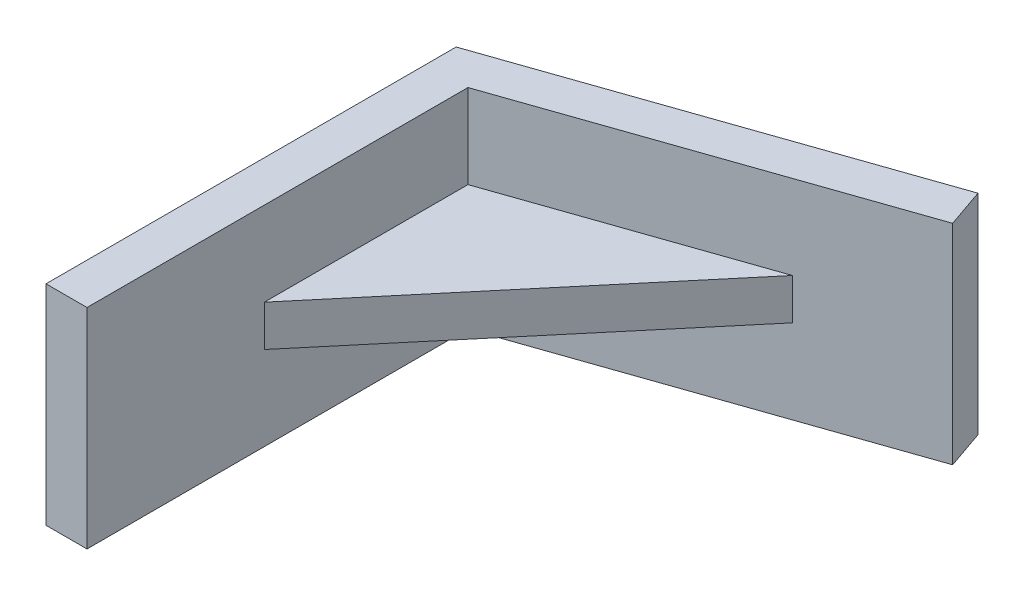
SolidWorks part; units mm, degrees
ref_plane "Alzado" through (0, 0, 0) normal (0, 0, 1) x (1, 0, 0)
ref_plane "Planta" through (0, 0, 0) normal (0, 1, 0) x (1, 0, 0)
ref_plane "Vista lateral" through (0, 0, 0) normal (1, 0, 0) x (0, 0, -1)
sketch "Croquis1" plane through (0, 0, 0) normal (0, 1, 0) x (1, 0, 0)
  line L0 (-5, 91.1176) -> (-5, -8.8824)
  line L1 (5, 84.0004) -> (5, -8.8824)
  line L2 (0, 0) -> (0, 14.5829) construction
  line L3 (-5, -8.8824) -> (23.8819, -8.8824) construction
  line L4 (-5, 91.1176) -> (89.4836, 123.8719)
  line L5 (-5, 91.1176) -> (40.075, 91.1176) construction
  line L6 (5, 84.0004) -> (92.7591, 114.4236)
  line L7 (89.4836, 123.8719) -> (101.5309, 89.1202) construction
  line L8 (-5, -8.8824) -> (5, -8.8824)
  line L9 (89.4836, 123.8719) -> (92.7591, 114.4236)
  point P13 (48.8795, 99.212)
  dimension "D1" = 5
  dimension "D2" = 100
  dimension "D4" = 19.12
  dimension "D5" = 10
  dimension "D6" = 100
extrude "Saliente-Extruir1" add sketch "Croquis1" along normal mid plane 51
sketch "Croquis2" plane through (0, 0, 0) normal (0, 1, 0) x (1, 0, 0)
  line L0 (5, 34.3626) -> (63.737, 104.3626)
  line L1 (5, -8.8824) -> (5, 84.0004) construction
  line L2 (5, 84.0004) -> (92.7591, 114.4236) construction
  dimension "D1" = 40
  dimension "D2" = 70
rib "Nervio1" sketch "Croquis2" sketch "Croquis2" thickness 10 extrusion direction parallel to sketch draft on no parameters "D1"=10
